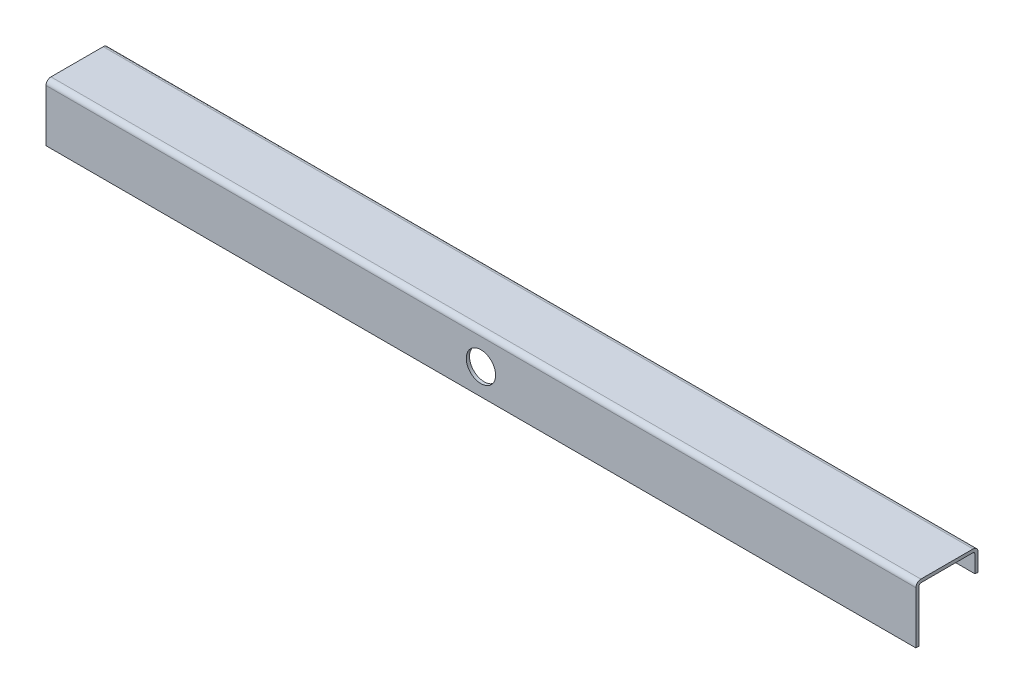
SolidWorks part; units mm, degrees
ref_plane "Front Plane" through (0, 0, 0) normal (0, 0, 1) x (1, 0, 0)
ref_plane "Top Plane" through (0, 0, 0) normal (0, 1, 0) x (1, 0, 0)
ref_plane "Right Plane" through (0, 0, 0) normal (1, 0, 0) x (0, 0, -1)
sketch "Sketch1" plane through (0, 0, 0) normal (1, 0, 0) x (0, 0, -1)
  line L0 (0, 19.9844) -> (0, 29.21)
  line L1 (-2.54, 31.75) -> (-29.21, 31.75)
  line L2 (-31.75, 29.21) -> (-31.75, 2.54)
  line L4 (-1.651, 20.3354) -> (-1.651, 29.21)
  line L5 (-2.54, 30.099) -> (-29.21, 30.099)
  line L6 (-30.099, 29.21) -> (-30.099, 2.54)
  line L8 (-1.651, 20.3354) -> (0, 19.9844)
  line L9 (-31.75, 2.54) -> (-30.099, 2.54)
  line L11 (-1.651, 2.54) -> (-1.651, 29.21) construction
  line L12 (0, 2.54) -> (0, 29.21) construction
  line L13 (-29.21, 1.651) -> (-2.54, 1.651) construction
  line L14 (-29.21, 0) -> (-2.54, 0) construction
  arc A2 (0, 29.21) -> (-2.54, 31.75) centre (-2.54, 29.21) ccw
  arc A3 (-31.75, 29.21) -> (-29.21, 31.75) centre (-29.21, 29.21) cw
  arc A4 (-1.651, 29.21) -> (-2.54, 30.099) centre (-2.54, 29.21) ccw
  arc A5 (-30.099, 29.21) -> (-29.21, 30.099) centre (-29.21, 29.21) cw
  arc A8 (-31.75, 2.54) -> (-29.21, 0) centre (-29.21, 2.54) ccw construction
  arc A9 (-30.099, 2.54) -> (-29.21, 1.651) centre (-29.21, 2.54) ccw construction
  arc A10 (0, 2.54) -> (-2.54, 0) centre (-2.54, 2.54) cw construction
  arc A11 (-1.651, 2.54) -> (-2.54, 1.651) centre (-2.54, 2.54) cw construction
  point P12 (0, 0)
  point P15 (0, 31.75)
  point P18 (-31.75, 31.75)
  dimension "D3" = 2.54
  dimension "D5" = 19.9844
  dimension "D1" = 31.75
  dimension "D2" = 31.75
  dimension "D6" = 20.3354
  dimension "D4" = 1.651
extrude "Boss-Extrude1" add sketch "Sketch1" along normal blind 177.8
scale "Scale1" scale about centroid uniform scaling no x scale factor 1 y scale factor 0.4 z scale factor 0.4
sketch "Sketch2" plane through (0, 0, 24.572) normal (0, 0, 1) x (1, 0, 0)
  line L0 (88.9, 15.4919) -> (88.9, 26.1599)
  line L1 (177.8, 15.4919) -> (0, 15.4919) construction
  line L2 (177.8, 26.1599) -> (0, 26.1599) construction
  circle A0 centre (88.9, 20.8259) radius 3
  point P6 (88.9, 20.8259)
  dimension "D1" = 6
extrude "Cut-Extrude1" cut sketch "Sketch2" against normal through all contours A0
